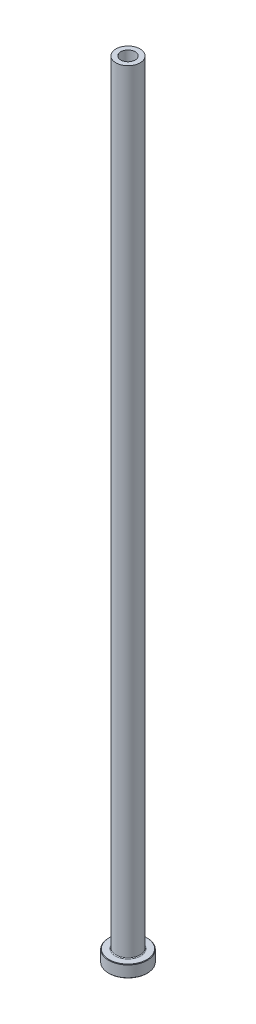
SolidWorks part; units mm, degrees
ref_plane "Front Plane" through (0, 0, 0) normal (0, 0, 1) x (1, 0, 0)
ref_plane "Top Plane" through (0, 0, 0) normal (0, 1, 0) x (1, 0, 0)
ref_plane "Right Plane" through (0, 0, 0) normal (1, 0, 0) x (0, 0, -1)
sketch "Sketch1" plane through (0, 0, 0) normal (0, 0, 1) x (1, 0, 0)
  line L0 (-3, 325) -> (-5, 325)
  line L1 (-5, 325) -> (-5, 5)
  line L2 (-5, 5) -> (-8, 5)
  line L3 (-8, 5) -> (-8, 0)
  line L4 (8.8, 0) -> (-8.8, 0) construction
  line L5 (-8, 0) -> (-3.25, 0)
  line L6 (-3, 280) -> (-3, 325)
  line L7 (0, 92.1877) -> (0, -15.5353) construction
  line L8 (0, -8.8) -> (0, 8.8) construction
  line L9 (-3, 280) -> (-3.25, 268)
  line L10 (-3.25, 268) -> (-3.25, 0)
  dimension "D1" = 0.25
  dimension "ID" = 6
  dimension "OD" = 10
  dimension "L" = 325
  dimension "H" = 16
  dimension "T" = 5
  dimension "N" = 45
  dimension "D2" = 12
revolve "Revolve1" add sketch "Sketch1" angle 360 about L7
fillet "Fillet1" radius 0.3 1 edges at (0, 5, 5)
chamfer "Chamfer1" distance 0.2 angle 45 2 edges at (0, 5, 8) (0, 0, 8)
chamfer "Chamfer3" distance 0.5 angle 45 1 edges at (0, 0, 3.25)
